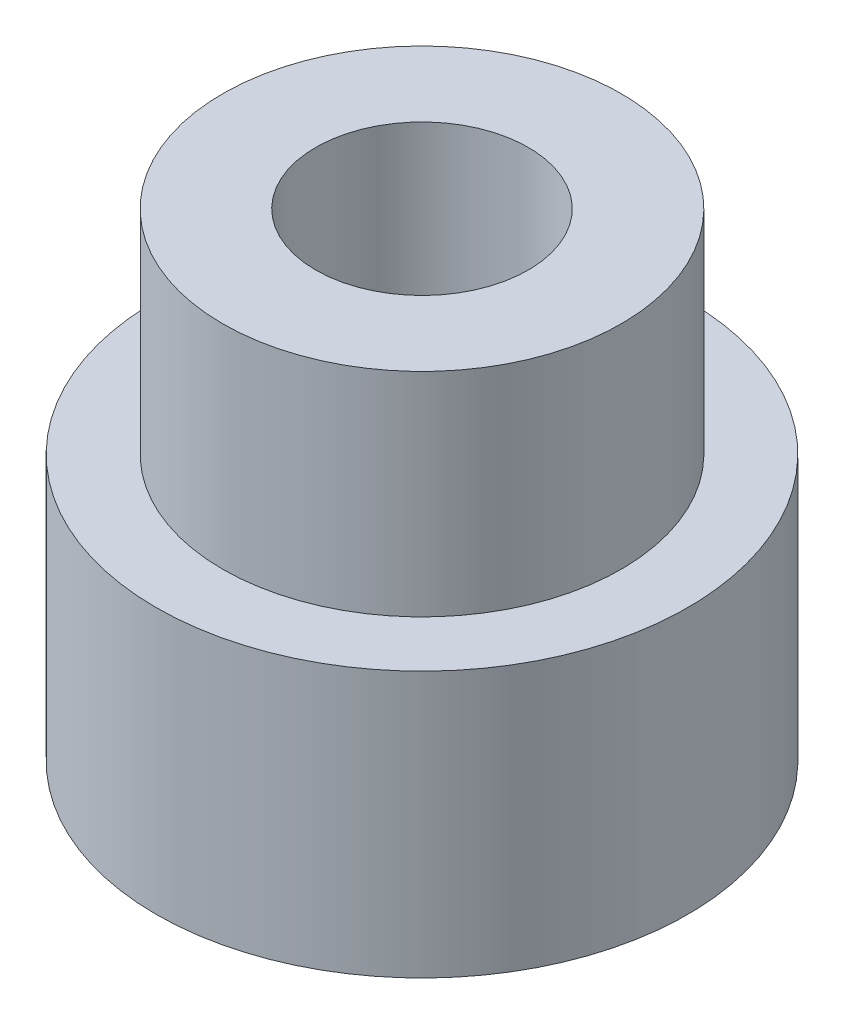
SolidWorks part; units mm, degrees
ref_plane "Vorne" through (0, 0, 0) normal (0, 0, 1) x (1, 0, 0)
ref_plane "Oben" through (0, 0, 0) normal (0, 1, 0) x (1, 0, 0)
ref_plane "Rechts" through (0, 0, 0) normal (1, 0, 0) x (0, 0, -1)
sketch "Skizze1" plane through (0, 0, 0) normal (0, 0, 1) x (1, 0, 0)
  line L0 (0, 0) -> (0, -24.6332) construction
  line L1 (8, 36) -> (8, 0)
  line L4 (8, 36) -> (15, 36)
  line L5 (15, 20) -> (15, 36)
  line L6 (15, 20) -> (20, 20)
  line L8 (8, 0) -> (20, 0)
  line L9 (20, 20) -> (20, 0)
  dimension "D1" = 8
  dimension "D2" = 15
  dimension "D3" = 20
  dimension "D4" = 20
  dimension "D5" = 16
revolve "Basis-Rotation" add sketch "Skizze1" angle 360 about L0
